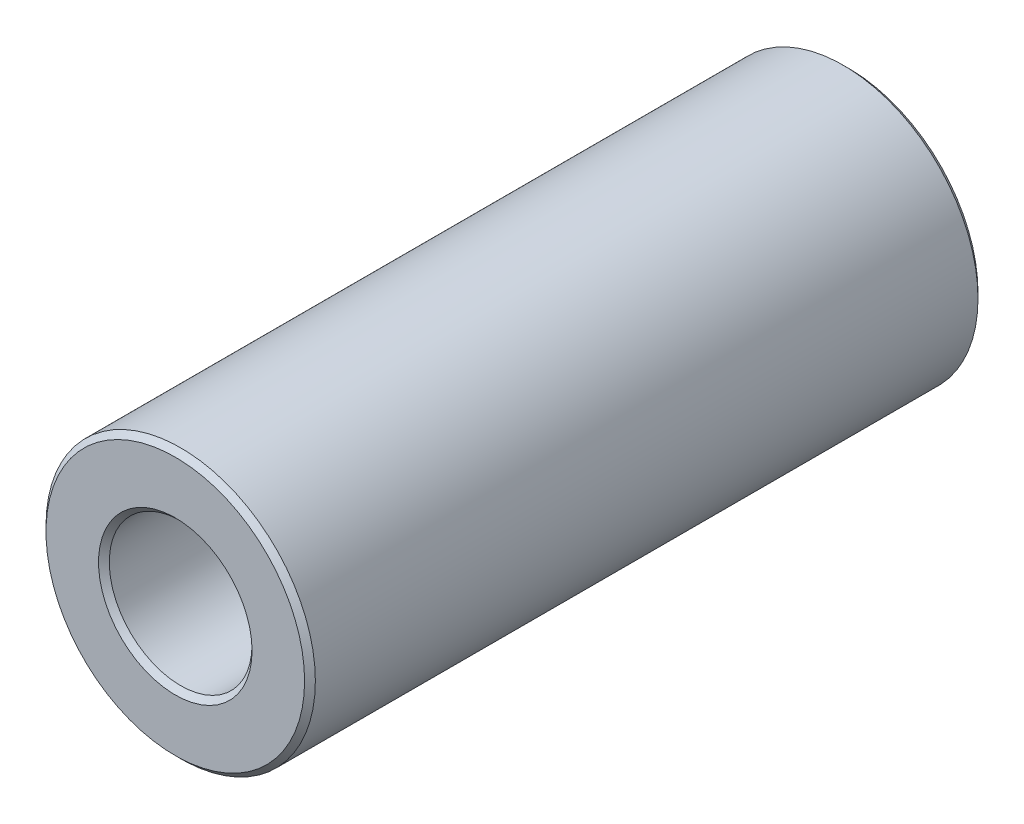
SolidWorks part; units mm, degrees
ref_plane "Front Plane" through (0, 0, 0) normal (0, 0, 1) x (1, 0, 0)
ref_plane "Top Plane" through (0, 0, 0) normal (0, 1, 0) x (1, 0, 0)
ref_plane "Right Plane" through (0, 0, 0) normal (1, 0, 0) x (0, 0, -1)
sketch "Sketch1" plane through (0, 0, 0) normal (0, 0, 1) x (1, 0, 0)
  circle A0 centre (0, 0) radius 5
  circle A1 centre (0, 0) radius 2.65
  dimension "D1" = 10
  dimension "D2" = 5.3
extrude "Boss-Extrude2" add sketch "Sketch1" along normal mid plane 25
chamfer "Chamfer3" distance 0.2 angle 45 4 edges at (5, 0, 12.5) (5, 0, -12.5) (2.65, 0, -12.5) (2.65, 0, 12.5)
